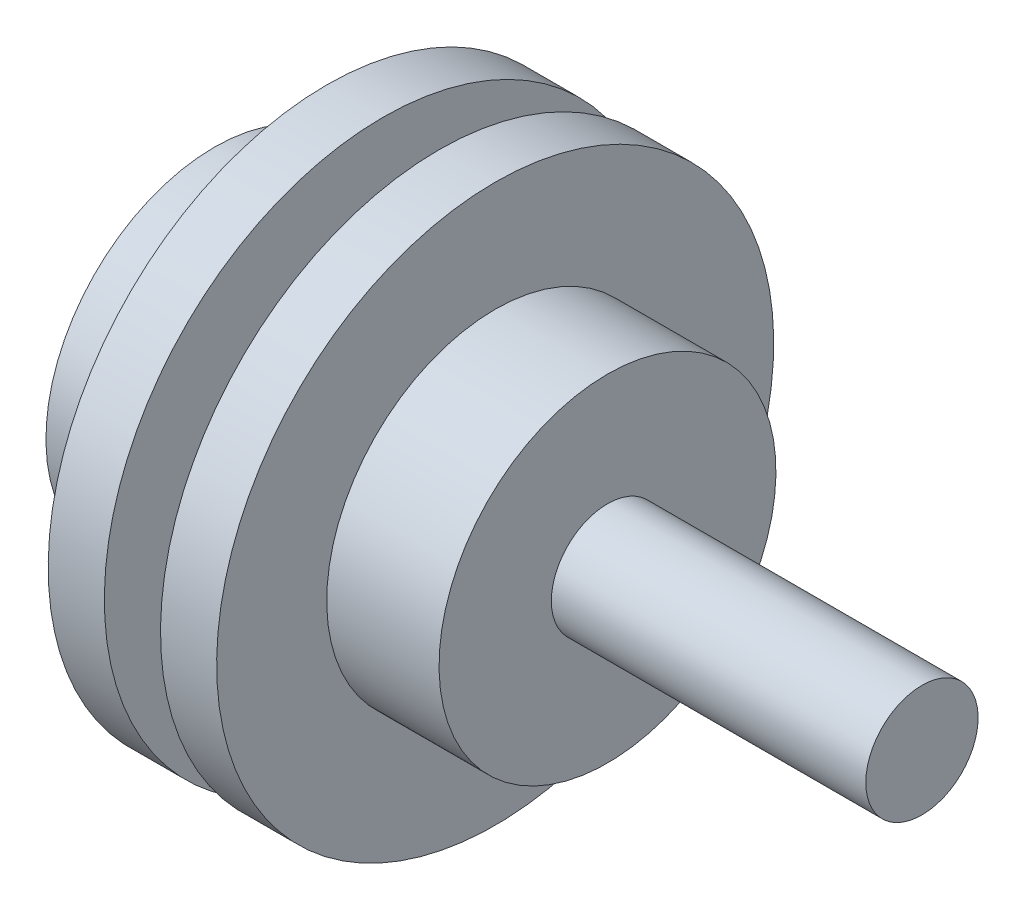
SolidWorks part; units mm, degrees
ref_plane "Front Plane" through (0, 0, 0) normal (0, 0, 1) x (1, 0, 0)
ref_plane "Top Plane" through (0, 0, 0) normal (0, 1, 0) x (1, 0, 0)
ref_plane "Right Plane" through (0, 0, 0) normal (1, 0, 0) x (0, 0, -1)
sketch "Sketch1" plane through (0, 0, 0) normal (0, 0, 1) x (1, 0, 0)
  line L0 (0, 0) -> (0, 12.446)
  line L1 (0, 12.446) -> (6.35, 12.446)
  line L2 (6.35, 12.446) -> (6.35, 0)
  line L3 (6.35, 0) -> (12.7, 0)
  line L4 (12.7, 0) -> (12.7, 12.446)
  line L5 (12.7, 12.446) -> (19.05, 12.446)
  line L6 (19.05, 12.446) -> (19.05, 0)
  line L7 (19.05, 0) -> (31.75, 0)
  line L8 (31.75, 0) -> (31.75, -19.05)
  line L9 (31.75, -19.05) -> (-12.7, -19.05)
  line L10 (-12.7, -19.05) -> (-12.7, 0)
  line L11 (-12.7, 0) -> (0, 0)
  point P14 (3.175, 12.446)
  point P15 (15.875, 12.446)
  dimension "D1" = 6.35
  dimension "D2" = 6.35
  dimension "D3" = 6.35
  dimension "D4" = 12.7
  dimension "D5" = 12.7
  dimension "D6" = 44.45
  dimension "D7" = 19.05
  dimension "D8" = 31.496
  dimension "D9" = 31.496
revolve "Revolve1" add sketch "Sketch1" angle 360 about L9
sketch "Sketch2" plane through (31.75, 0, 0) normal (1, 0, 0) x (0, 0, -1)
  circle A0 centre (0, -19.05) radius 6.35
  dimension "D1" = 12.7
extrude "Boss-Extrude1" add sketch "Sketch2" along normal blind 35.56
